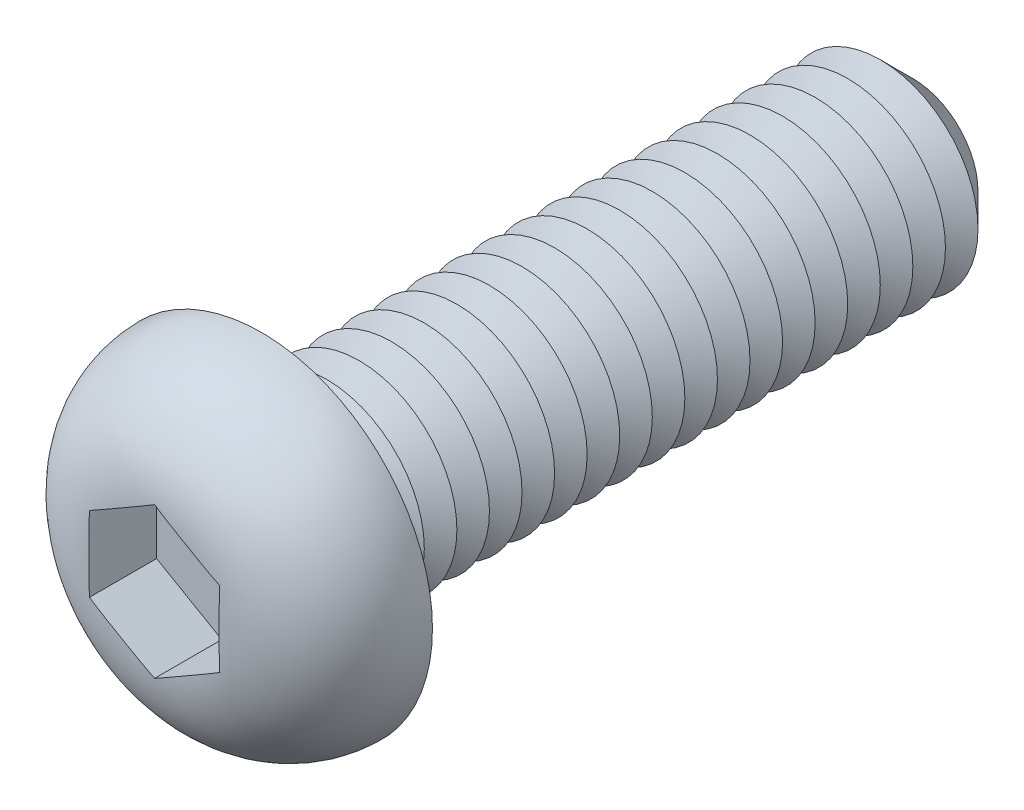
SolidWorks part; units mm, degrees
ref_plane "Front Plane" through (0, 0, 0) normal (0, 0, 1) x (1, 0, 0)
ref_plane "Top Plane" through (0, 0, 0) normal (0, 1, 0) x (1, 0, 0)
ref_plane "Right Plane" through (0, 0, 0) normal (1, 0, 0) x (0, 0, -1)
sketch "Sketch1" plane through (0, 0, 0) normal (1, 0, 0) x (0, 0, -1)
  line L0 (-47.9342, 0) -> (60.3146, 0) construction
sketch "Sketch2" plane through (0, 0, 0) normal (1, 0, 0) x (0, 0, -1)
  line L0 (0, 0) -> (-3.3, 0)
  line L1 (-47.9342, 0) -> (60.3146, 0) construction
  line L2 (-3.3, 0) -> (-3.3, 1.95)
  line L3 (0, 5.25) -> (0, 0)
  arc A0 (-3.3, 1.95) -> (0, 5.25) centre (0, 1.95) cw
  dimension "D1" = 3.3
  dimension "D2" = 3.3
  dimension "D3" = 5.25
revolve "Revolve1" add sketch "Sketch2" angle 360 about L0
sketch "Sketch3" plane through (0, 0, 3.3) normal (0, 0, 1) x (1, 0, 0)
  line L1 (0, 2.3094) -> (-2, 1.1547)
  line L2 (-2, 1.1547) -> (-2, -1.1547)
  line L3 (-2, -1.1547) -> (0, -2.3094)
  line L4 (0, -2.3094) -> (2, -1.1547)
  line L5 (2, -1.1547) -> (2, 1.1547)
  line L6 (2, 1.1547) -> (0, 2.3094)
  circle A0 centre (0, 0) radius 2 construction
  dimension "D1" = 4
extrude "Cut-Extrude1" cut sketch "Sketch3" against normal blind 2.08
sketch "Sketch4" plane through (0, 0, 0) normal (0, 0, -1) x (-1, 0, 0)
  circle A0 centre (0, 0) radius 3
  dimension "D1" = 6
extrude "Boss-Extrude1" add sketch "Sketch4" along normal blind 20
chamfer "Chamfer1" distance 1 angle 45 1 edges at (-3, 0, -20)
sketch "Sketch5" plane through (0, 0, 0) normal (1, 0, 0) x (0, 0, -1)
  line L0 (1, 3) -> (2, 3)
  line L1 (19, 3) -> (0, 3) construction
  line L2 (2, 3) -> (1.5, 2.134)
  line L3 (1.5, 2.134) -> (1, 3)
  line L4 (0, -5.25) -> (0, 5.25) construction
  line L5 (19, 3) -> (0, 3) construction
  dimension "D1" = 1
  dimension "D2" = 1
revolve "Cut-Revolve1" cut sketch "Sketch5" angle 360 about L0
pattern_linear "LPattern1" count 18 spacing 1 along (0, 0, -1) of "Cut-Revolve1"
fillet "Fillet2" radius 0.5 1 edges at (3, 0, 0)
sketch "Sketch6" plane through (0, 0, 1.22) normal (0, 0, 1) x (1, 0, 0)
  circle A0 centre (0, 0) radius 0.8
  dimension "D1" = 1.6
extrude "Cut-Extrude2" cut sketch "Sketch6" against normal up to surface (21.22 mm away)
